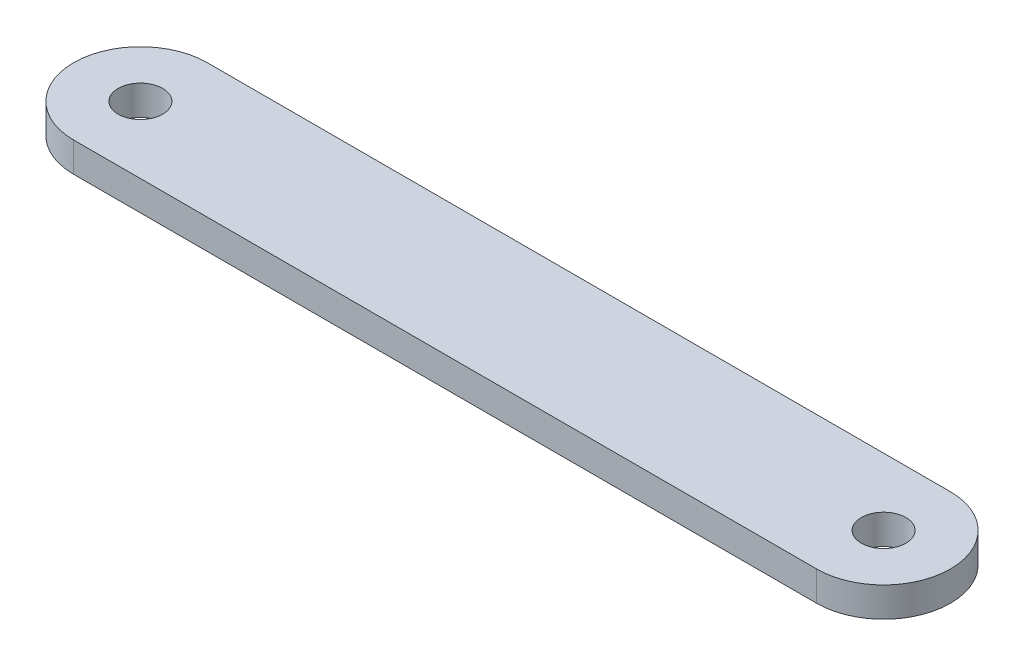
SolidWorks part; units mm, degrees
ref_plane "Front Plane" through (0, 0, 0) normal (0, 0, 1) x (1, 0, 0)
ref_plane "Top Plane" through (0, 0, 0) normal (0, 1, 0) x (1, 0, 0)
ref_plane "Right Plane" through (0, 0, 0) normal (1, 0, 0) x (0, 0, -1)
sketch "Sketch1" plane through (0, 0, 0) normal (0, 1, 0) x (1, 0, 0)
  line L1 (-25, 4.5) -> (25, 4.5)
  line L3 (-25, -4.5) -> (25, -4.5)
  line L5 (-25, 4.5) -> (25, -4.5) construction
  line L6 (-25, -4.5) -> (25, 4.5) construction
  arc A0 (25, 4.5) -> (25, -4.5) centre (25, 0) cw
  arc A1 (-25, 4.5) -> (-25, -4.5) centre (-25, 0) ccw
  point P0 (0, 0)
  dimension "D1" = 50
  dimension "D2" = 9
extrude "Boss-Extrude1" add sketch "Sketch1" along normal blind 2
sketch "Sketch2" plane through (0, 2, 0) normal (0, 1, 0) x (1, 0, 0)
  circle A0 centre (-25, 0) radius 1.5
  circle A1 centre (25, 0) radius 1.5
  dimension "D1" = 3
extrude "Cut-Extrude1" cut sketch "Sketch2" against normal blind 2
